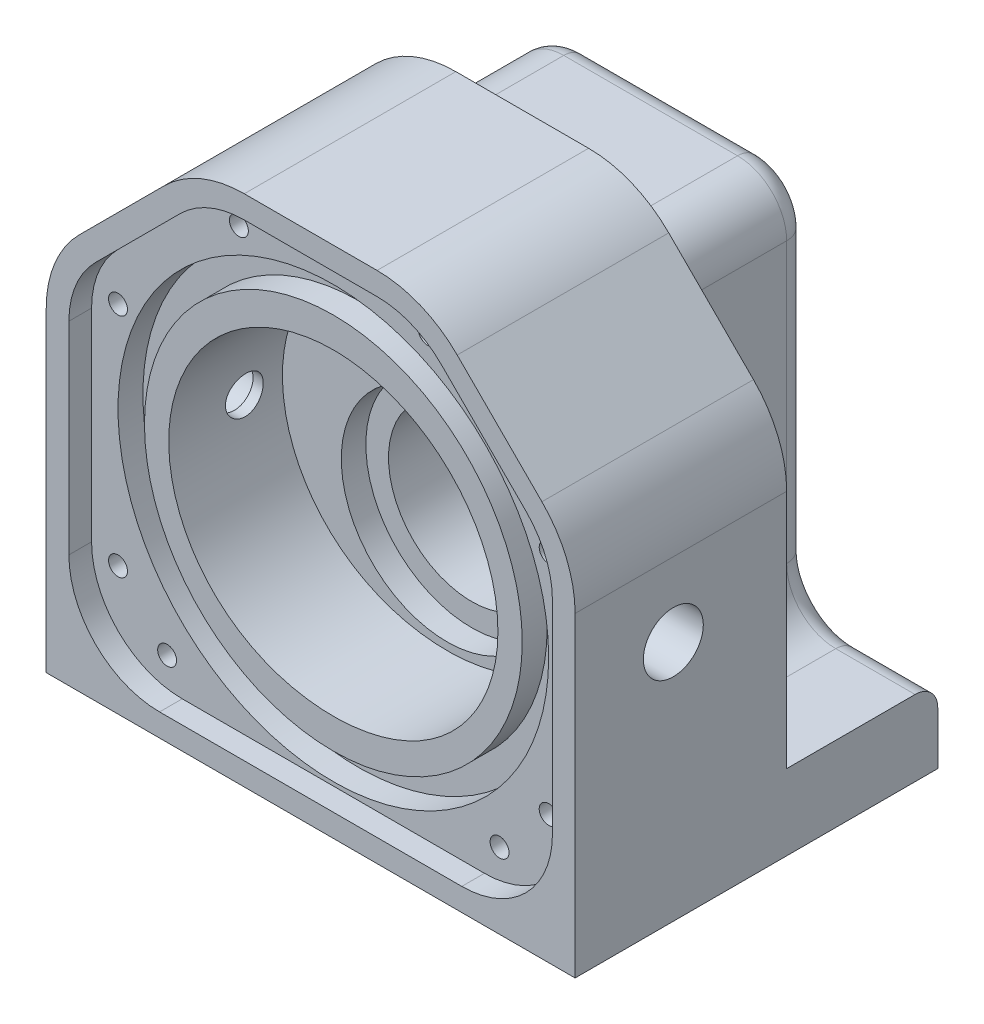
SolidWorks part; units mm, degrees
ref_plane "Face" through (0, 0, 0) normal (0, 0, 1) x (1, 0, 0)
ref_plane "Dessus" through (0, 0, 0) normal (0, 1, 0) x (1, 0, 0)
ref_plane "Droite" through (0, 0, 0) normal (1, 0, 0) x (0, 0, -1)
sketch "Esquisse1" plane through (0, 0, 0) normal (0, 0, 1) x (1, 0, 0)
  line L1 (-35, -32) -> (35, -32)
  line L2 (-35, -32) -> (-35, 38)
  line L3 (-35, 38) -> (35, 38)
  line L4 (35, -32) -> (35, 38)
  dimension "D1" = 70
  dimension "D2" = 70
  dimension "D3" = 32
  dimension "D4" = 35
extrude "brut 70 x 70 x 50" add sketch "Esquisse1" along normal blind 50
sketch "Esquisse 1" plane through (0, 0, 0) normal (0, 0, -1) x (-1, 0, 0)
  line L4 (35, -32) -> (35, 38)
  line L5 (35, 38) -> (-35, 38)
  line L6 (-35, 38) -> (-35, -32)
  line L7 (-35, -32) -> (35, -32)
  line L8 (35, -32) -> (35, 38)
  line L9 (35, 38) -> (-35, 38)
  line L10 (-35, 38) -> (-35, -32)
  line L11 (-35, -32) -> (35, -32)
  dimension "D1" = 0
extrude "Surfaçage ph 10" cut sketch "Esquisse 1" against normal blind 1
sketch "Esquisse 2" plane through (0, 0, 1) normal (0, 0, -1) x (-1, 0, 0)
  line L0 (-35, -22) -> (-24.5, -22)
  line L1 (-18, -15.5) -> (-18, 21.5)
  line L2 (-11.5, 28) -> (11.5, 28)
  line L3 (18, 21.5) -> (18, -15.5)
  line L4 (-35, -32) -> (35, -32)
  line L5 (35, -32) -> (35, 38)
  line L6 (35, 38) -> (-35, 38)
  line L7 (-35, 38) -> (-35, -32)
  line L8 (-35, -32) -> (35, -32)
  line L9 (35, -32) -> (35, -22)
  line L11 (-35, -22) -> (-35, -32)
  line L12 (24.5, -22) -> (35, -22)
  arc A0 (-24.5, -22) -> (-18, -15.5) centre (-24.5, -15.5) ccw
  arc A1 (-18, 21.5) -> (-11.5, 28) centre (-11.5, 21.5) cw
  arc A2 (18, 21.5) -> (11.5, 28) centre (11.5, 21.5) ccw
  arc A3 (18, -15.5) -> (24.5, -22) centre (24.5, -15.5) ccw
  point P15 (-18, 28)
  point P18 (18, 28)
  dimension "D6" = 6.5
  dimension "D2" = 10
  dimension "D3" = 60
  dimension "D4" = 18
  dimension "D5" = 36
  dimension "D1" = 0
extrude "Contournage ph 10" cut sketch "Esquisse 2" against normal blind 20 flip side to cut
fillet "Arrondi ph 10" radius 3
sketch "Esquisse 3" plane through (0, 0, 50) normal (0, 0, 1) x (1, 0, 0)
  line L4 (-35, 38) -> (-35, -32)
  line L5 (-35, -32) -> (35, -32)
  line L6 (35, -32) -> (35, 38)
  line L7 (35, 38) -> (-35, 38)
  line L8 (-35, 38) -> (-35, -32)
  line L9 (-35, -32) -> (35, -32)
  line L10 (35, -32) -> (35, 38)
  line L11 (35, 38) -> (-35, 38)
  dimension "D1" = 0
extrude "Surfaçage ph 20" cut sketch "Esquisse 3" against normal offset from surface (1 mm away) 48
sketch "Esquisse 4" plane through (0, 0, 49) normal (0, 0, 1) x (1, 0, 0)
  line L0 (-35, -32) -> (35, -32) construction
  line L1 (19.3934, 31.6066) -> (30.6066, 20.3934)
  line L2 (-19.3934, 31.6066) -> (-30.6066, 20.3934)
  line L3 (-35, 38) -> (-35, -32) construction
  line L4 (35, 38) -> (-35, 38)
  line L5 (-35, 38) -> (-35, -32)
  line L6 (-35, -32) -> (35, -32)
  line L7 (35, -32) -> (35, 38)
  line L9 (-35, 9.7868) -> (-35, -32)
  line L10 (-35, -32) -> (35, -32)
  line L11 (35, -32) -> (35, 9.7868)
  line L14 (-8.7868, 36) -> (8.7868, 36)
  arc A0 (-19.3934, 31.6066) -> (-8.7868, 36) centre (-8.7868, 21) cw
  arc A1 (-30.6066, 20.3934) -> (-35, 9.7868) centre (-20, 9.7868) ccw
  arc A2 (30.6066, 20.3934) -> (35, 9.7868) centre (20, 9.7868) cw
  arc A3 (19.3934, 31.6066) -> (8.7868, 36) centre (8.7868, 21) ccw
  point P14 (-15, 36)
  point P19 (15, 36)
  dimension "D6" = 20
  dimension "D7" = 15
  dimension "D8" = 15
  dimension "D2" = 135
  dimension "D3" = 135
  dimension "D4" = 68
  dimension "D5" = 30
  dimension "D1" = 0
extrude "Contour ph 20" cut sketch "Esquisse 4" against normal blind 30 flip side to cut
sketch "Esquisse 5" plane through (0, 0, 49) normal (0, 0, 1) x (1, 0, 0)
  circle A0 centre (0, -6) radius 8.25
  dimension "D1" = 16.5
  dimension "D2" = 6
extrude "Perçage Ø16,5  ph 20" cut sketch "Esquisse 5" against normal through all
sketch "Positions points" plane through (0, 0, 49) normal (0, 0, 1) x (1, 0, 0)
  point P0 (0, 21)
  point P1 (2.351, 20.875)
  point P2 (4.673, 20.5)
  point P3 (6.935, 19.883)
  point P5 (11.173, 17.961)
  point P6 (9.111, 19.032)
  point P7 (13.098, 16.687)
  point P8 (14.864, 15.228)
  point P9 (16.453, 13.608)
  point P10 (17.849, 11.849)
  point P11 (19.041, 9.978)
  point P12 (20.021, 8.019)
  point P13 (20.785, 6)
  point P14 (21.331, 3.947)
  point P15 (21.662, 1.884)
  point P16 (21.784, -0.163)
  point P17 (21.707, -2.172)
  point P18 (21.441, -4.124)
  point P19 (20.399, -7.785)
  point P20 (21, -6)
  point P21 (19.655, -9.466)
  point P22 (18.784, -11.033)
  point P23 (17.805, -12.481)
  point P24 (16.734, -13.803)
  point P25 (15.588, -15)
  point P26 (14.383, -16.071)
  point P27 (13.133, -17.019)
  point P28 (11.849, -17.849)
  point P29 (10.544, -18.566)
  point P30 (9.226, -19.176)
  point P31 (7.902, -19.687)
  point P32 (6.577, -20.104)
  point P33 (5.254, -20.435)
  point P34 (3.935, -20.686)
  point P35 (2.621, -20.862)
  point P36 (1.309, -20.966)
  point P37 (0, -21)
  point P40 (-1.309, -20.966)
  point P41 (-2.621, -20.862)
  point P42 (-3.935, -20.686)
  point P43 (-5.254, -20.435)
  point P44 (-6.577, -20.104)
  point P45 (-7.902, -19.687)
  point P46 (-9.226, -19.176)
  point P47 (-10.544, -18.566)
  point P48 (-11.849, -17.849)
  point P49 (-13.133, -17.019)
  point P50 (-14.383, -16.071)
  point P51 (-15.588, -15)
  point P52 (-16.734, -13.803)
  point P53 (-17.805, -12.481)
  point P54 (-18.784, -11.033)
  point P55 (-19.655, -9.466)
  point P56 (-21, -6)
  point P57 (-20.399, -7.785)
  point P58 (-21.441, -4.124)
  point P59 (-21.707, -2.172)
  point P60 (-21.784, -0.163)
  point P61 (-21.662, 1.884)
  point P62 (-21.331, 3.947)
  point P63 (-20.785, 6)
  point P64 (-20.021, 8.019)
  point P65 (-19.041, 9.978)
  point P66 (-17.849, 11.849)
  point P67 (-16.453, 13.608)
  point P68 (-14.864, 15.228)
  point P69 (-13.098, 16.687)
  point P70 (-9.111, 19.032)
  point P71 (-11.173, 17.961)
  point P72 (-6.935, 19.883)
  point P73 (-4.673, 20.5)
  point P74 (-2.351, 20.875)
curve "Courbe2"
sketch "Esquisse 6" plane through (0, 0, 49) normal (0, 0, 1) x (1, 0, 0)
  line L18 (8.7868, 33) -> (-8.7868, 33)
  line L19 (28.4853, 18.2721) -> (17.2721, 29.4853)
  line L20 (32, -29) -> (32, 9.7868)
  line L21 (-32, -29) -> (32, -29)
  line L22 (-32, 9.7868) -> (-32, -29)
  line L23 (-17.2721, 29.4853) -> (-28.4853, 18.2721)
  line L24 (8.7868, 33) -> (-8.7868, 33)
  line L25 (28.4853, 18.2721) -> (17.2721, 29.4853)
  line L26 (32, -17) -> (32, 9.7868)
  line L27 (-20, -29) -> (20, -29)
  line L28 (-32, 9.7868) -> (-32, -17)
  line L29 (-17.2721, 29.4853) -> (-28.4853, 18.2721)
  arc A8 (-20, -29) -> (-32, -17) centre (-20, -17) cw
  arc A9 (32, -17) -> (20, -29) centre (20, -17) cw
  arc A12 (-8.7868, 33) -> (-17.2721, 29.4853) centre (-8.7868, 21) ccw
  arc A13 (17.2721, 29.4853) -> (8.7868, 33) centre (8.7868, 21) ccw
  arc A14 (32, 9.7868) -> (28.4853, 18.2721) centre (20, 9.7868) ccw
  arc A15 (-28.4853, 18.2721) -> (-32, 9.7868) centre (-20, 9.7868) ccw
  arc A16 (-8.7868, 33) -> (-17.2721, 29.4853) centre (-8.7868, 21) ccw
  arc A17 (17.2721, 29.4853) -> (8.7868, 33) centre (8.7868, 21) ccw
  arc A18 (32, 9.7868) -> (28.4853, 18.2721) centre (20, 9.7868) ccw
  arc A19 (-28.4853, 18.2721) -> (-32, 9.7868) centre (-20, 9.7868) ccw
  dimension "D1" = 3
  dimension "D2" = 12
extrude "Logement pléxiglass ph 20" cut sketch "Esquisse 6" against normal blind 3
sketch "Esquisse 7" plane through (0, 0, 46) normal (0, 0, 1) x (1, 0, 0)
  point P0 (0, 21)
  dimension "D1" = 0
extrude "Concoïde ph 20" cut sketch "Esquisse 7" against normal blind 15.05
sketch "Esquisse 8" plane through (0, 0, 30.95) normal (0, 0, 1) x (1, 0, 0)
  circle A0 centre (0, -6) radius 14
  dimension "D1" = 28
extrude "Logement colerette ph 20" cut sketch "Esquisse 8" against normal blind 3.25
sketch "Esquisse 9" plane through (0, 0, 27.7) normal (0, 0, 1) x (1, 0, 0)
  circle A0 centre (0, -6) radius 11
  dimension "D1" = 22
extrude "Alésage bague ph20" cut sketch "Esquisse 9" against normal blind 23
sketch "Esquisse 10" plane through (0, 0, 46) normal (0, 0, 1) x (1, 0, 0)
  circle A0 centre (0, 0) radius 28.5
  circle A1 centre (0, 0) radius 25
  dimension "D1" = 57
  dimension "D2" = 50
extrude "Logement joint ph20" cut sketch "Esquisse 10" against normal blind 3.3
hole_wizard "Trou taraudé M3x0.5 ph20" positions "Esquisse 11" profile "Esquisse 12" tap size "M3x0.5" standard "Ansi Métrique"
sketch "Esquisse 11" plane through (0, 0, 46) normal (0, 0, 1) x (1, 0, 0)
  point P0 (-22, -25)
  point P1 (-28.5, -18)
  point P2 (-28.5, 12)
  point P3 (-12.5, 29)
  point P4 (12.5, 29)
  point P5 (28.5, 12)
  point P6 (28.5, -18)
  point P7 (22, -25)
  dimension "D1" = 28.5
  dimension "D2" = 12
  dimension "D3" = 29
  dimension "D4" = 12.5
  dimension "D5" = 25
  dimension "D6" = 57
  dimension "D7" = 18
  dimension "D8" = 25
  dimension "D9" = 22
  dimension "D10" = 44
sketch "Esquisse 12" plane through (-22, -25, 46) normal (1, 0, 0) x (0, -1, 0)
  line L0 (0, 0) -> (0, 9.2511)
  line L1 (0, 9.2511) -> (1.25, 8.5)
  line L2 (1.25, 8.5) -> (1.25, 0)
  line L5 (1.25, 0) -> (0, 0)
  line L10 (0, 9.2511) -> (-1.25, 8.5) construction
  line L11 (0, -6.35) -> (0, 107.95) construction
  dimension "Diamètre du perçage" = 2.5
  dimension "Profondeur du perçage" = 8.5
  dimension "Angle de pointe" = 118
sketch "Esquisse 13" plane through (35, 0, 0) normal (1, 0, 0) x (0, 0, -1)
  line L0 (-49, -32) -> (-49, 9.7868) construction
  circle A0 centre (-36, 0) radius 2.5
  dimension "D2" = 5
  dimension "D1" = 13
extrude "Percage Ø5 ph 30" cut sketch "Esquisse 13" against normal through all
hole_wizard "Trou taraudé 3/8-16 ph 30" positions "Esquisse 14" profile "Esquisse 15" tap size "3/8-16" standard "Ansi Pouce"
sketch "Esquisse 14" plane through (-35, 0, 0) normal (-1, 0, 0) x (0, 0, 1)
  circle A0 centre (36, 0) radius 2.5 construction
  point P0 (36, 0)
sketch "Esquisse 15" plane through (-35, 0, 36) normal (0, 1, 0) x (0, 0, 1)
  line L0 (0, 0) -> (0, 13.3847)
  line L1 (0, 13.3847) -> (3.9687, 11)
  line L2 (3.9687, 11) -> (3.9687, 0)
  line L5 (3.9687, 0) -> (0, 0)
  line L10 (0, 13.3847) -> (-3.9688, 11) construction
  line L11 (0, -6.35) -> (0, 107.95) construction
  dimension "Diamètre du perçage" = 7.9375
  dimension "Profondeur du perçage" = 11
  dimension "Angle de pointe" = 118
hole_wizard "Trou taraudé 3/8-16   ph 30" positions "Esquisse 16" profile "Esquisse 17" tap size "3/8-16" standard "Ansi Pouce"
sketch "Esquisse 16" plane through (35, 0, 0) normal (1, 0, 0) x (0, 0, -1)
  circle A0 centre (-36, 0) radius 2.5 construction
  point P0 (-36, 0)
sketch "Esquisse 17" plane through (35, 0, 36) normal (0, 1, 0) x (0, 0, -1)
  line L0 (0, 0) -> (0, 13.3847)
  line L1 (0, 13.3847) -> (3.9687, 11)
  line L2 (3.9687, 11) -> (3.9687, 0)
  line L5 (3.9687, 0) -> (0, 0)
  line L10 (0, 13.3847) -> (-3.9688, 11) construction
  line L11 (0, -6.35) -> (0, 107.95) construction
  dimension "Diamètre du perçage" = 7.9375
  dimension "Profondeur du perçage" = 11
  dimension "Angle de pointe" = 118
